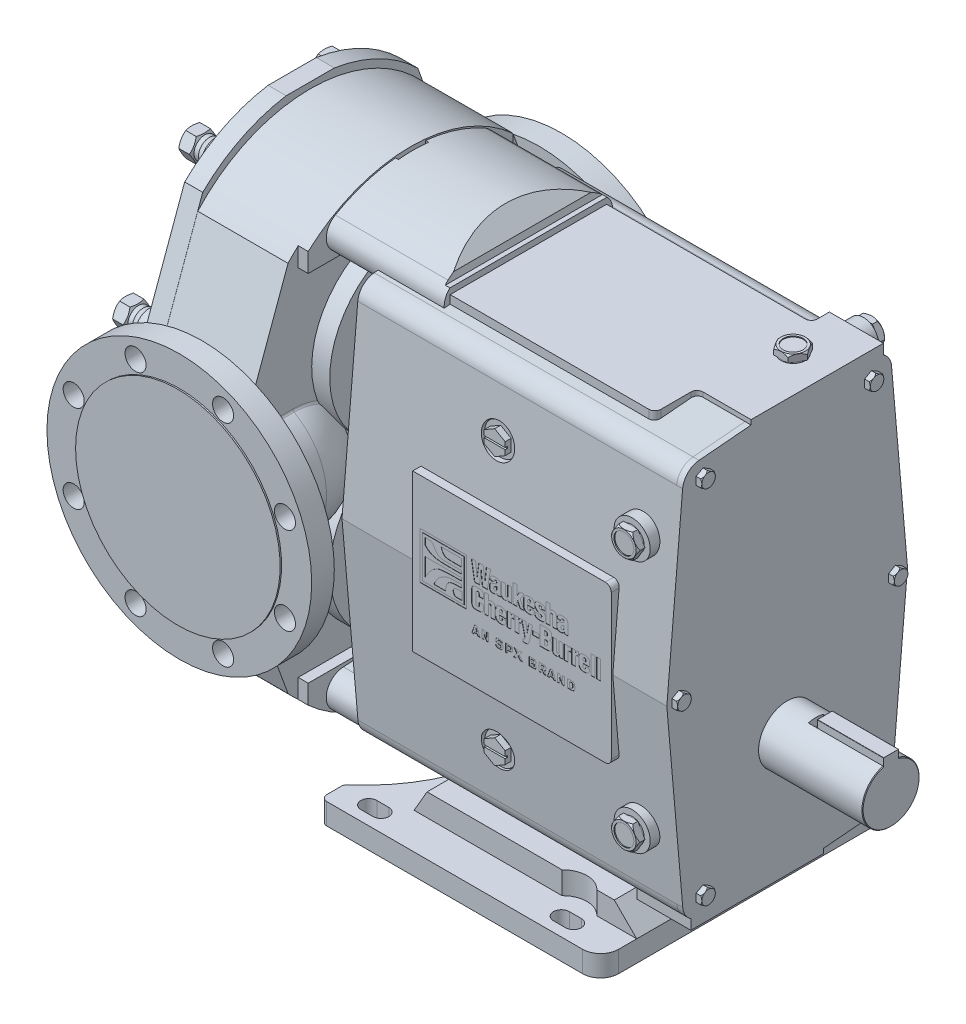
SolidWorks part; units mm, degrees
ref_plane "Front Plane" through (0, 0, 0) normal (0, 0, 1) x (1, 0, 0)
ref_plane "Top Plane" through (0, 0, 0) normal (0, 1, 0) x (1, 0, 0)
ref_plane "Right Plane" through (0, 0, 0) normal (1, 0, 0) x (0, 0, -1)
other "Join1"
other "grease fitting<4>@320_U2_Lower Shaft"
other "grease fitting<2>@320_U2_Lower Shaft"
other "cleanout plug<2>@320_U2_Lower Shaft"
other "oil plug<6>@320_U2_Lower Shaft"
other "oil plug<4>@320_U2_Lower Shaft"
other "108373<8>@320_U2_Lower Shaft"
other "108373<7>@320_U2_Lower Shaft"
other "108373<6>@320_U2_Lower Shaft"
other "108373<4>@320_U2_Lower Shaft"
other "108373<3>@320_U2_Lower Shaft"
other "108373<2>@320_U2_Lower Shaft"
other "Key_320<1>@320_U2_Lower Shaft"
other "Shaft_320 U2<1>@320_U2_Lower Shaft"
other "new cover_gearcase_40669<1>@320_U2_Lower Shaft"
other "grease fitting<3>@320_U2_Lower Shaft"
other "grease fitting<1>@320_U2_Lower Shaft"
other "cleanout plug<1>@320_U2_Lower Shaft"
other "oil plug<5>@320_U2_Lower Shaft"
other "oil plug<3>@320_U2_Lower Shaft"
other "oil plug<2>@320_U2_Lower Shaft"
other "oil plug<1>@320_U2_Lower Shaft"
other "108373<5>@320_U2_Lower Shaft"
other "108373<1>@320_U2_Lower Shaft"
other "105406<2>@320_U2_Lower Shaft"
other "109968<1>@320_U2_Lower Shaft"
other "40288<1>@320_U2_Lower Shaft"
other "105478<1>@320_U2_Lower Shaft"
other "body_shim-210-320-370U2<2>@320_U2_Lower Shaft"
other "body_shim-210-320-370U2<1>@320_U2_Lower Shaft"
